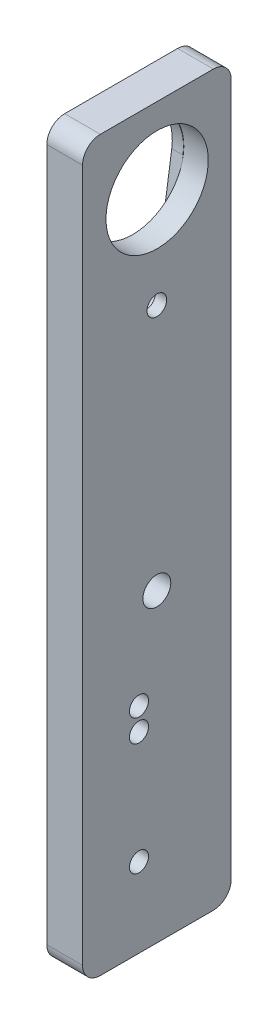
SolidWorks part; units mm, degrees
ref_plane "Front Plane" through (0, 0, 0) normal (0, 0, 1) x (1, 0, 0)
ref_plane "Top Plane" through (0, 0, 0) normal (0, 1, 0) x (1, 0, 0)
ref_plane "Right Plane" through (0, 0, 0) normal (1, 0, 0) x (0, 0, -1)
imported_body "Forearm of 3 DOF Arm-1-solid1"
sketch "Sketch2" plane through (-45.951, 0, 0) normal (-1, 0, 0) x (0, 0, 1)
  line L7 (-7.3793, 46.7667) -> (-4.1896, 25.1097)
  line L8 (-4.1896, 25.1097) -> (7.4366, 25.1097)
  line L9 (10.6264, 46.7667) -> (7.4366, 25.1097)
  line L10 (11.6735, 61.6776) -> (-8.4265, 61.6776) construction
  line L11 (14.8485, -64.7474) -> (14.8485, 58.5026) construction
  arc A5 (10.6264, 46.7667) -> (-7.3793, 46.7667) centre (1.6235, 48.0927) ccw
  dimension "D1" = 9.1
  dimension "D2" = 13.5849
  dimension "D3" = 22.983
  dimension "D4" = 13.225
  dimension "D5" = 21.657
extrude "Cut-Extrude1" cut sketch "Sketch2" against normal blind 2
sketch "Sketch3" plane through (-45.951, 0, 0) normal (-1, 0, 0) x (0, 0, 1)
  circle A0 centre (1.6235, 30.3127) radius 4
extrude "Cut-Extrude2" cut sketch "Sketch3" against normal through all
sketch "Sketch5" plane through (-43.951, 0, 0) normal (-1, 0, 0) x (0, 0, 1)
  circle A0 centre (1.5732, 48.0961) radius 9.1
  dimension "D1" = 18.2
extrude "Cut-Extrude3" cut sketch "Sketch5" against normal through all
sketch "Sketch6" plane through (-45.951, 0, 0) normal (-1, 0, 0) x (0, 0, 1)
  circle A0 centre (1.6235, -13.66) radius 2.4812
  dimension "D1" = 4.9625
extrude "Cut-Extrude4" cut sketch "Sketch6" against normal blind 10
sketch "Sketch8" plane through (-45.951, 0, 0) normal (-1, 0, 0) x (0, 0, 1)
  circle A2 centre (4.7985, -29.8224) radius 1.7
  circle A3 centre (4.7985, -29.8224) radius 1.7
  circle A5 centre (4.7985, -33.8224) radius 1.7
  circle A6 centre (4.7985, -33.8224) radius 1.7
  circle A8 centre (4.7985, -53.8224) radius 1.7
  circle A9 centre (4.7985, -53.8224) radius 1.7
  dimension "D1" = 0.15
  dimension "D2" = 0.15
  dimension "D3" = 0.15
extrude "Cut-Extrude5" cut sketch "Sketch8" against normal through all
sketch "Sketch9" plane through (-39.601, 0, 0) normal (1, 0, 0) x (0, 0, -1)
  circle A0 centre (-1.6235, 30.3127) radius 4
  circle A1 centre (-1.6235, 30.3127) radius 1.75
  dimension "D1" = 3.5
  dimension "D2" = 8
extrude "Boss-Extrude1" add sketch "Sketch9" against normal blind 2
